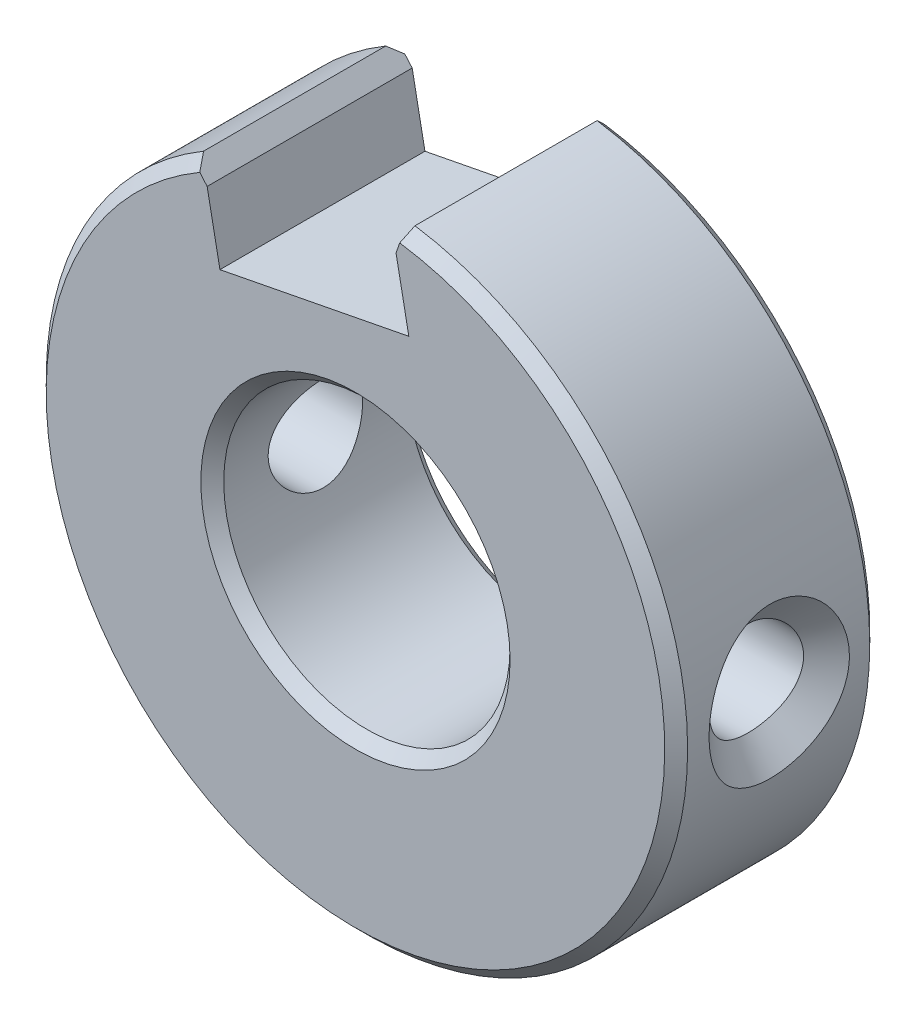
SolidWorks part; units mm, degrees
ref_plane "Plan1" through (0, 0, 0) normal (0, 0, 1) x (1, 0, 0)
ref_plane "Plan2" through (0, 0, 0) normal (0, 1, 0) x (1, 0, 0)
ref_plane "Plan3" through (0, 0, 0) normal (1, 0, 0) x (0, 0, -1)
sketch "Esquisse1" plane through (0, 0, 0) normal (0, 0, 1) x (1, 0, 0)
  line L0 (-30.2, 0) -> (32.8, 0) construction
  line L1 (0, -29.6) -> (0, 29.8) construction
  line L2 (0, 0) -> (-5.8037, 29.8576) construction
  line L3 (-12.9478, 22.5874) -> (-11.8329, 16.8518)
  line L4 (-11.8329, 16.8518) -> (4.6585, 20.0574)
  line L5 (3.5436, 25.793) -> (4.6585, 20.0574)
  line L6 (-12.9478, 22.5874) -> (-14.2599, 24.0968)
  line L7 (3.5436, 25.793) -> (4.1947, 27.684)
  arc A0 (-14.2599, 24.0968) -> (4.1947, 27.684) centre (0, 0) ccw
  circle A1 centre (0, 0) radius 12.5
  dimension "D1" = 25
  dimension "D2" = 56
  dimension "D4" = 18.8
  dimension "D3" = 11
  dimension "D5" = 16.8
  dimension "D6" = 30
  dimension "D7" = 1
extrude "Base-Extrusion" add sketch "Esquisse1" along normal blind 17.9
chamfer "Chanfrein1" distance 1 angle 45
sketch "Esquisse2" plane through (0, 0, 0) normal (1, 0, 0) x (0, 0, -1)
  line L0 (-16.9, 0) -> (-1, 0) construction
  line L1 (0, -27) -> (0, 26.7221) construction
  circle A0 centre (-8.9, 0) radius 4.125
  dimension "D2" = 8.25
  dimension "D1" = 8.9
extrude "Enlèv. mat.-Extru.1" cut sketch "Esquisse2" against normal mid plane 60
chamfer "Chanfrein2" distance 2 angle 45
